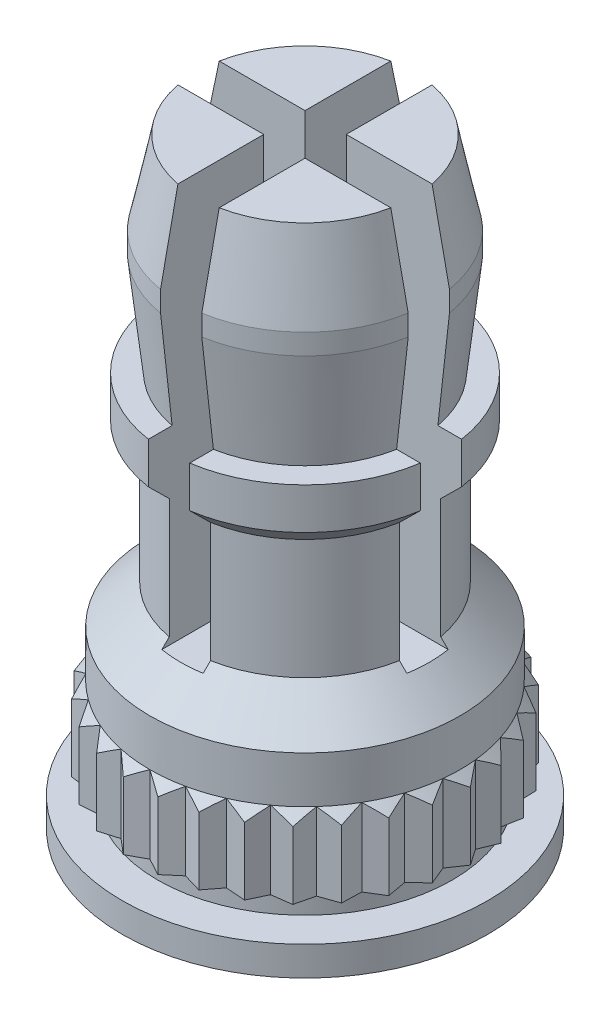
SolidWorks part; units mm, degrees
revolve "Body" add sketch "BodySke" angle 360 about L9
sketch "BodySke" plane through (0, 0, 0) normal (0, 0, 1) x (1, 0, 0)
  line L0 (2.5578, 0) -> (2.5578, 0.381)
  line L1 (2.6924, 2.5354) -> (2.0295, 3.1984)
  line L2 (2.8702, 1.5494) -> (2.6924, 1.7272)
  line L3 (2.0295, 3.1984) -> (2.0295, 5.2756)
  line L4 (0, -0.508) -> (3.175, -0.508)
  line L5 (3.175, -0.508) -> (3.175, 0)
  line L6 (3.175, 0) -> (2.5578, 0)
  line L7 (2.3876, 5.6337) -> (2.3876, 6.35)
  line L8 (2.6924, 1.7272) -> (2.6924, 2.5354)
  line L9 (0, -0.508) -> (0, 17.145) construction
  line L10 (2.3876, 6.35) -> (1.9812, 6.35)
  line L11 (1.9812, 6.35) -> (2.1793, 8.1407)
  line L12 (2.1793, 8.1407) -> (2.1793, 8.4988)
  line L13 (2.1793, 8.4988) -> (1.8821, 9.9314)
  line L14 (1.8821, 9.9314) -> (0, 9.9314)
  line L15 (2.5578, 0.381) -> (2.8702, 0.381)
  line L16 (2.8702, 0.381) -> (2.8702, 1.5494)
  line L17 (0, 9.9314) -> (0, -0.508)
  line L19 (2.3876, 5.6337) -> (2.0295, 5.2756)
ref_plane "Plane1" through (0, 0, 0) normal (0, 0, 1) x (1, 0, 0)
ref_plane "Plane2" through (0, 0, 0) normal (0, 1, 0) x (1, 0, 0)
ref_plane "Plane3" through (0, 0, 0) normal (1, 0, 0) x (0, 0, -1)
other "Configuration Table"
sketch "SlitCutSke" plane through (0, 9.9314, 0) normal (0, 1, 0) x (-1, 0, 0)
  line L0 (-2.6685, 0.3581) -> (2.6685, 0.3581)
  line L1 (2.6685, -0.3581) -> (-2.6685, -0.3581)
  line L2 (-2.6685, 0.3581) -> (-2.6685, -0.3581)
  line L3 (2.6685, 0.3581) -> (2.6685, -0.3581)
  line L4 (-4.064, 0) -> (4.064, 0) construction
  circle A1 centre (0, 0) radius 2.6924 construction
extrude "SlitCut" cut sketch "SlitCutSke" against normal blind 6.86
pattern_circular "SlitCutPat" count 2 every 90 about axis through (0, -0.508, 0) along (0, 1, 0) of "SlitCut"
ref_plane "Plane4" through (0, -0.5486, 0) normal (0, 1, 0) x (-1, 0, 0)
sketch "CliRinCutSke" plane through (0, 0.381, 0) normal (0, -1, 0) x (1, 0, 0)
  line L0 (0.3, 2.8545) -> (0, 2.6924)
  line L1 (0, 2.6924) -> (-0.3, 2.8545)
  line L2 (0, 0) -> (0, 5.842) construction
  arc A1 (0.3, 2.8545) -> (-0.3, 2.8545) centre (0, 0) ccw
  circle A2 centre (0, 0) radius 2.6924 construction
extrude "ClinchCut" cut sketch "CliRinCutSke" against normal blind 1.3462
pattern_circular "ClinchCutPat" count 30 every 12 about axis through (0, -0.508, 0) along (0, 1, 0) of "ClinchCut"
equation "' \"Panel_dia@BodySke\" = 0.156"
equation "' \"Length@BodySke\" = 0.25"
equation "' \"B_dia@BodySke\" = 0.188"
equation "' \"C_dia@BodySke\" = 0.212"
equation "' \"D_ht@BodySke\" = 0.141"
equation "' \"H_dia@BodySke\" = 0.25"
equation "' \"T_ht@BodySke\" = 0.02"
equation "' \"Clinch_dia@BodySke\" = 0.226"
equation "\"Tip_dia@BodySke\" = \"Panel_dia@BodySke\" * 0.95"
equation "\"Slip_dia@BodySke\" = \"Panel_dia@BodySke\" * 1.1"
equation "\"Slip_ht@BodySke\" = \"D_ht@BodySke\" * 0.1"
equation "\"Grip_ht@BodySke\" = \"D_ht@BodySke\" * 0.5"
equation "\"B_ht@BodySke\" = \"B_dia@BodySke\" * 0.15"
equation "\"Neck_dia@BodySke\" = \"B_dia@BodySke\" * 0.85"
equation "\"Neck_len@BodySke\" = \"B_dia@BodySke\" * 0.66"
equation "\"Groove_dia@BodySke\" = \"C_dia@BodySke\" * 0.95"
equation "\"Groove_wid@BodySke\" = \"T_ht@BodySke\" * 0.75"
equation "\"Width@SlitCutSke\" = \"B_ht@BodySke\""
equation "\"Depth@SlitCut\" = \"D_ht@BodySke\" + \"Neck_len@BodySke\" + 0.005"
equation "\"Clinch_lim@BodySke\" = \"C_dia@BodySke\" * 0.25"
equation "\"Count@ClinchCutPat\" = 30"
equation "\"Angle@ClinchCutPat\" = 360 / \"Count@ClinchCutPat\""
equation "\"Angle@CliRinCutSke\" = 360 / \"Count@ClinchCutPat\""
equation "\"Clinch_dia@CliRinCutSke\" = \"Clinch_dia@BodySke\""
equation "\"Clinch_minor@CliRinCutSke\" = \"C_dia@BodySke\""
equation "\"Depth@ClinchCut\" = \"Clinch_lim@BodySke\""
